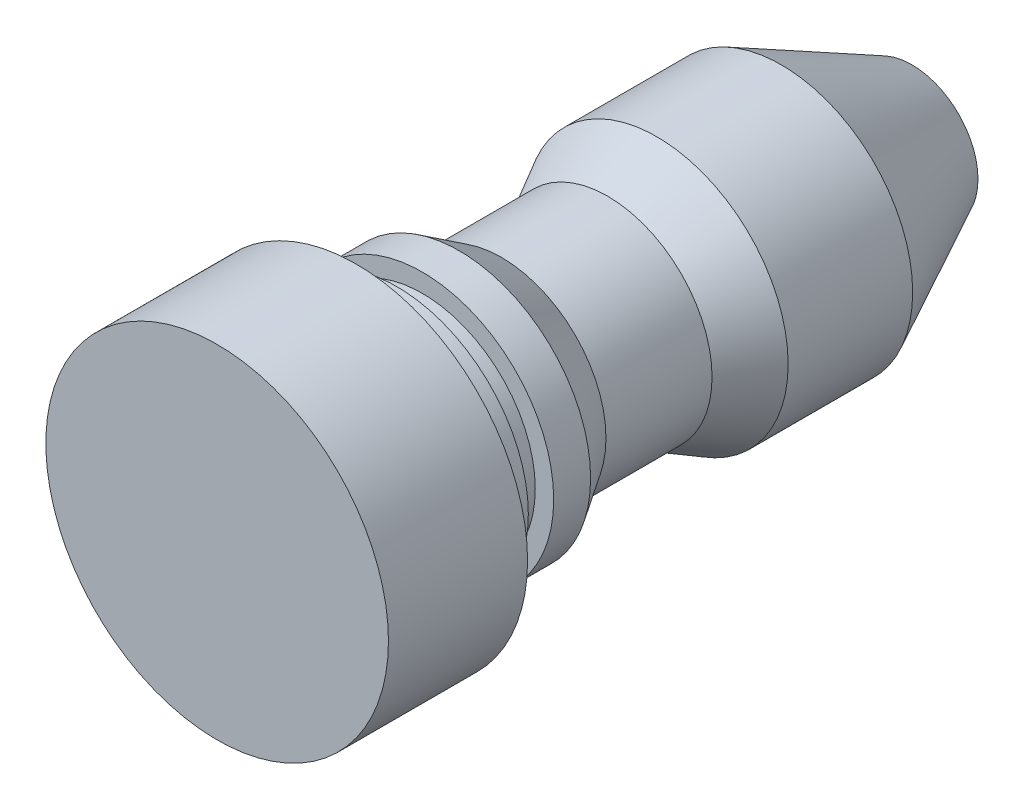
SolidWorks part; units mm, degrees
ref_plane "Front Plane" through (0, 0, 0) normal (0, 0, 1) x (1, 0, 0)
ref_plane "Top Plane" through (0, 0, 0) normal (0, 1, 0) x (1, 0, 0)
ref_plane "Right Plane" through (0, 0, 0) normal (1, 0, 0) x (0, 0, -1)
sketch "Sketch1" plane through (0, 0, 0) normal (1, 0, 0) x (0, 0, -1)
  line L0 (-36.2237, 0) -> (36.2237, 0) construction
  line L1 (-26.0805, 0) -> (-26.0805, 10.0186)
  line L2 (-26.0805, 10.0186) -> (-17.9441, 10.0186)
  line L3 (-17.9441, 10.0186) -> (-17.9441, 7.6811)
  line L4 (-17.9441, 7.6811) -> (-15.5616, 7.6811)
  line L5 (-15.5616, 7.6811) -> (-15.5616, 6.6022)
  line L6 (-14.0782, 6.6022) -> (-14.0782, 7.6811)
  line L7 (-14.0782, 7.6811) -> (-11.9205, 7.6811)
  line L8 (-11.9205, 7.6811) -> (-9.4481, 6.1078)
  line L9 (-9.4481, 6.1078) -> (-3.2446, 6.1078)
  line L10 (-3.2446, 6.1078) -> (-0.3677, 7.6811)
  line L11 (-0.3677, 7.6811) -> (6.9147, 7.6811)
  line L12 (6.9147, 7.6811) -> (14.5566, 3.8601)
  line L13 (14.5566, 3.8601) -> (14.5566, 0)
  line L14 (14.5566, 0) -> (-26.0805, 0)
  line L15 (-15.5616, 6.6022) -> (-14.0782, 6.6022)
  point P4 (0, 0)
revolve "Revolve1" add sketch "Sketch1" angle 360 about L0
